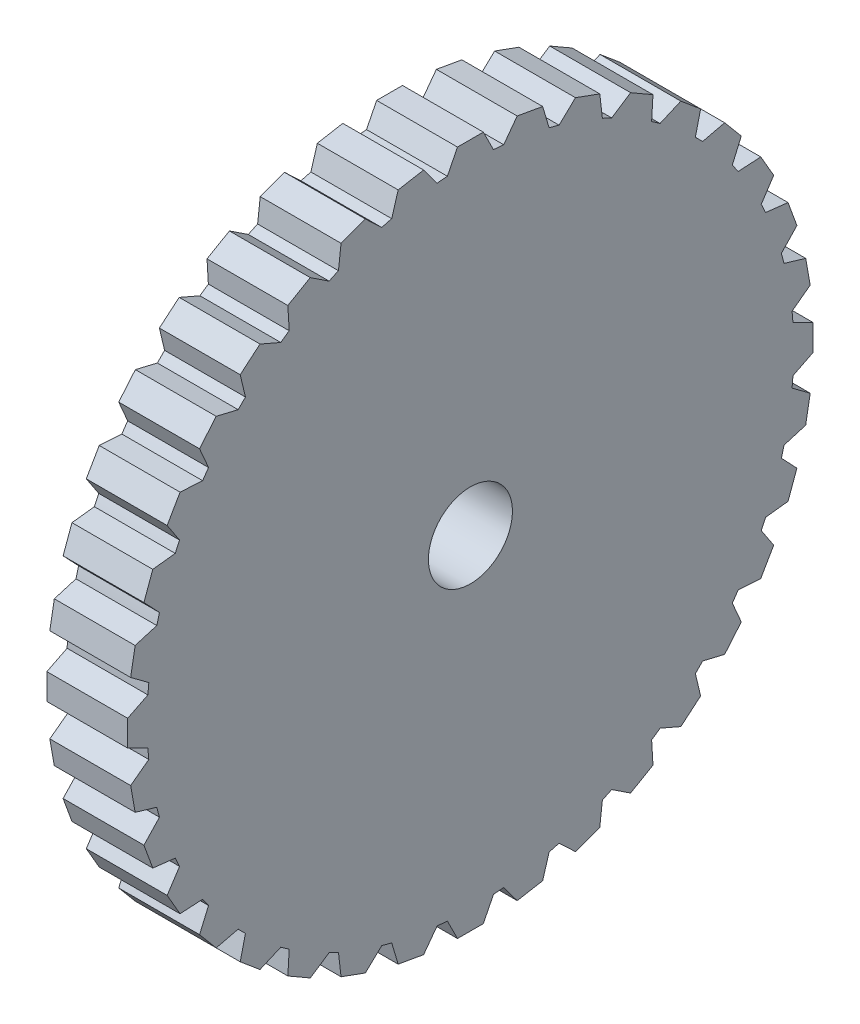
SolidWorks part; units mm, degrees
ref_plane "Front Plane" through (0, 0, 0) normal (0, 0, 1) x (1, 0, 0)
ref_plane "Top Plane" through (0, 0, 0) normal (0, 1, 0) x (1, 0, 0)
ref_plane "Right Plane" through (0, 0, 0) normal (1, 0, 0) x (0, 0, -1)
sketch "Sketch1" plane through (0, 0, 0) normal (1, 0, 0) x (0, 0, -1)
  circle A0 centre (0, 0) radius 12.7
extrude "Boss-Extrude1" add sketch "Sketch1" along normal blind 3.175
sketch "Sketch2" plane through (3.175, 0, 0) normal (1, 0, 0) x (0, 0, -1)
  line L0 (1.8374, 13.3457) -> (2.8379, 13.1693)
  line L1 (2.8379, 13.1693) -> (3.1618, 12.0805)
  line L2 (-0.508, 13.462) -> (0.508, 13.462)
  line L3 (0.508, 13.462) -> (1.016, 12.446)
  line L4 (-1.016, 12.446) -> (1.016, 12.446)
  line L5 (-0.508, 13.462) -> (-1.016, 12.446)
  line L6 (1.1607, 12.4333) -> (3.1618, 12.0805)
  line L7 (1.8374, 13.3457) -> (1.1607, 12.4333)
  line L8 (4.1269, 12.8239) -> (5.0816, 12.4764)
  line L9 (5.0816, 12.4764) -> (5.2115, 11.3479)
  line L10 (3.3021, 12.0429) -> (5.2115, 11.3479)
  line L11 (4.1269, 12.8239) -> (3.3021, 12.0429)
  line L12 (6.2911, 11.9124) -> (7.1709, 11.4044)
  line L13 (7.1709, 11.4044) -> (7.1029, 10.2706)
  line L14 (5.3431, 11.2866) -> (7.1029, 10.2706)
  line L15 (6.2911, 11.9124) -> (5.3431, 11.2866)
  line L16 (8.2641, 10.639) -> (9.0424, 9.986)
  line L17 (9.0424, 9.986) -> (8.7784, 8.8811)
  line L18 (7.2218, 10.1873) -> (8.7784, 8.8811)
  line L19 (8.2641, 10.639) -> (7.2218, 10.1873)
  line L20 (9.986, 9.0424) -> (10.639, 8.2641)
  line L21 (10.639, 8.2641) -> (10.1873, 7.2218)
  line L22 (8.8811, 8.7784) -> (10.1873, 7.2218)
  line L23 (9.986, 9.0424) -> (8.8811, 8.7784)
  line L24 (11.4044, 7.1709) -> (11.9124, 6.2911)
  line L25 (11.9124, 6.2911) -> (11.2866, 5.3431)
  line L26 (10.2706, 7.1029) -> (11.2866, 5.3431)
  line L27 (11.4044, 7.1709) -> (10.2706, 7.1029)
  line L28 (12.4764, 5.0816) -> (12.8239, 4.1269)
  line L29 (12.8239, 4.1269) -> (12.0429, 3.3021)
  line L30 (11.3479, 5.2115) -> (12.0429, 3.3021)
  line L31 (12.4764, 5.0816) -> (11.3479, 5.2115)
  line L32 (13.1693, 2.8379) -> (13.3457, 1.8374)
  line L33 (13.3457, 1.8374) -> (12.4333, 1.1607)
  line L34 (12.0805, 3.1618) -> (12.4333, 1.1607)
  line L35 (13.1693, 2.8379) -> (12.0805, 3.1618)
  line L36 (13.462, 0.508) -> (13.462, -0.508)
  line L37 (13.462, -0.508) -> (12.446, -1.016)
  line L38 (12.446, 1.016) -> (12.446, -1.016)
  line L39 (13.462, 0.508) -> (12.446, 1.016)
  line L40 (13.3457, -1.8374) -> (13.1693, -2.8379)
  line L41 (13.1693, -2.8379) -> (12.0805, -3.1618)
  line L42 (12.4333, -1.1607) -> (12.0805, -3.1618)
  line L43 (13.3457, -1.8374) -> (12.4333, -1.1607)
  line L44 (12.8239, -4.1269) -> (12.4764, -5.0816)
  line L45 (12.4764, -5.0816) -> (11.3479, -5.2115)
  line L46 (12.0429, -3.3021) -> (11.3479, -5.2115)
  line L47 (12.8239, -4.1269) -> (12.0429, -3.3021)
  line L48 (11.9124, -6.2911) -> (11.4044, -7.1709)
  line L49 (11.4044, -7.1709) -> (10.2706, -7.1029)
  line L50 (11.2866, -5.3431) -> (10.2706, -7.1029)
  line L51 (11.9124, -6.2911) -> (11.2866, -5.3431)
  line L52 (10.639, -8.2641) -> (9.986, -9.0424)
  line L53 (9.986, -9.0424) -> (8.8811, -8.7784)
  line L54 (10.1873, -7.2218) -> (8.8811, -8.7784)
  line L55 (10.639, -8.2641) -> (10.1873, -7.2218)
  line L56 (9.0424, -9.986) -> (8.2641, -10.639)
  line L57 (8.2641, -10.639) -> (7.2218, -10.1873)
  line L58 (8.7784, -8.8811) -> (7.2218, -10.1873)
  line L59 (9.0424, -9.986) -> (8.7784, -8.8811)
  line L60 (7.1709, -11.4044) -> (6.2911, -11.9124)
  line L61 (6.2911, -11.9124) -> (5.3431, -11.2866)
  line L62 (7.1029, -10.2706) -> (5.3431, -11.2866)
  line L63 (7.1709, -11.4044) -> (7.1029, -10.2706)
  line L64 (5.0816, -12.4764) -> (4.1269, -12.8239)
  line L65 (4.1269, -12.8239) -> (3.3021, -12.0429)
  line L66 (5.2115, -11.3479) -> (3.3021, -12.0429)
  line L67 (5.0816, -12.4764) -> (5.2115, -11.3479)
  line L68 (2.8379, -13.1693) -> (1.8374, -13.3457)
  line L69 (1.8374, -13.3457) -> (1.1607, -12.4333)
  line L70 (3.1618, -12.0805) -> (1.1607, -12.4333)
  line L71 (2.8379, -13.1693) -> (3.1618, -12.0805)
  line L72 (0.508, -13.462) -> (-0.508, -13.462)
  line L73 (-0.508, -13.462) -> (-1.016, -12.446)
  line L74 (1.016, -12.446) -> (-1.016, -12.446)
  line L75 (0.508, -13.462) -> (1.016, -12.446)
  line L76 (-1.8374, -13.3457) -> (-2.8379, -13.1693)
  line L77 (-2.8379, -13.1693) -> (-3.1618, -12.0805)
  line L78 (-1.1607, -12.4333) -> (-3.1618, -12.0805)
  line L79 (-1.8374, -13.3457) -> (-1.1607, -12.4333)
  line L80 (-4.1269, -12.8239) -> (-5.0816, -12.4764)
  line L81 (-5.0816, -12.4764) -> (-5.2115, -11.3479)
  line L82 (-3.3021, -12.0429) -> (-5.2115, -11.3479)
  line L83 (-4.1269, -12.8239) -> (-3.3021, -12.0429)
  line L84 (-6.2911, -11.9124) -> (-7.1709, -11.4044)
  line L85 (-7.1709, -11.4044) -> (-7.1029, -10.2706)
  line L86 (-5.3431, -11.2866) -> (-7.1029, -10.2706)
  line L87 (-6.2911, -11.9124) -> (-5.3431, -11.2866)
  line L88 (-8.2641, -10.639) -> (-9.0424, -9.986)
  line L89 (-9.0424, -9.986) -> (-8.7784, -8.8811)
  line L90 (-7.2218, -10.1873) -> (-8.7784, -8.8811)
  line L91 (-8.2641, -10.639) -> (-7.2218, -10.1873)
  line L92 (-9.986, -9.0424) -> (-10.639, -8.2641)
  line L93 (-10.639, -8.2641) -> (-10.1873, -7.2218)
  line L94 (-8.8811, -8.7784) -> (-10.1873, -7.2218)
  line L95 (-9.986, -9.0424) -> (-8.8811, -8.7784)
  line L96 (-11.4044, -7.1709) -> (-11.9124, -6.2911)
  line L97 (-11.9124, -6.2911) -> (-11.2866, -5.3431)
  line L98 (-10.2706, -7.1029) -> (-11.2866, -5.3431)
  line L99 (-11.4044, -7.1709) -> (-10.2706, -7.1029)
  line L100 (-12.4764, -5.0816) -> (-12.8239, -4.1269)
  line L101 (-12.8239, -4.1269) -> (-12.0429, -3.3021)
  line L102 (-11.3479, -5.2115) -> (-12.0429, -3.3021)
  line L103 (-12.4764, -5.0816) -> (-11.3479, -5.2115)
  line L104 (-13.1693, -2.8379) -> (-13.3457, -1.8374)
  line L105 (-13.3457, -1.8374) -> (-12.4333, -1.1607)
  line L106 (-12.0805, -3.1618) -> (-12.4333, -1.1607)
  line L107 (-13.1693, -2.8379) -> (-12.0805, -3.1618)
  line L108 (-13.462, -0.508) -> (-13.462, 0.508)
  line L109 (-13.462, 0.508) -> (-12.446, 1.016)
  line L110 (-12.446, -1.016) -> (-12.446, 1.016)
  line L111 (-13.462, -0.508) -> (-12.446, -1.016)
  line L112 (-13.3457, 1.8374) -> (-13.1693, 2.8379)
  line L113 (-13.1693, 2.8379) -> (-12.0805, 3.1618)
  line L114 (-12.4333, 1.1607) -> (-12.0805, 3.1618)
  line L115 (-13.3457, 1.8374) -> (-12.4333, 1.1607)
  line L116 (-12.8239, 4.1269) -> (-12.4764, 5.0816)
  line L117 (-12.4764, 5.0816) -> (-11.3479, 5.2115)
  line L118 (-12.0429, 3.3021) -> (-11.3479, 5.2115)
  line L119 (-12.8239, 4.1269) -> (-12.0429, 3.3021)
  line L120 (-11.9124, 6.2911) -> (-11.4044, 7.1709)
  line L121 (-11.4044, 7.1709) -> (-10.2706, 7.1029)
  line L122 (-11.2866, 5.3431) -> (-10.2706, 7.1029)
  line L123 (-11.9124, 6.2911) -> (-11.2866, 5.3431)
  line L124 (-10.639, 8.2641) -> (-9.986, 9.0424)
  line L125 (-9.986, 9.0424) -> (-8.8811, 8.7784)
  line L126 (-10.1873, 7.2218) -> (-8.8811, 8.7784)
  line L127 (-10.639, 8.2641) -> (-10.1873, 7.2218)
  line L128 (-9.0424, 9.986) -> (-8.2641, 10.639)
  line L129 (-8.2641, 10.639) -> (-7.2218, 10.1873)
  line L130 (-8.7784, 8.8811) -> (-7.2218, 10.1873)
  line L131 (-9.0424, 9.986) -> (-8.7784, 8.8811)
  line L132 (-7.1709, 11.4044) -> (-6.2911, 11.9124)
  line L133 (-6.2911, 11.9124) -> (-5.3431, 11.2866)
  line L134 (-7.1029, 10.2706) -> (-5.3431, 11.2866)
  line L135 (-7.1709, 11.4044) -> (-7.1029, 10.2706)
  line L136 (-5.0816, 12.4764) -> (-4.1269, 12.8239)
  line L137 (-4.1269, 12.8239) -> (-3.3021, 12.0429)
  line L138 (-5.2115, 11.3479) -> (-3.3021, 12.0429)
  line L139 (-5.0816, 12.4764) -> (-5.2115, 11.3479)
  line L140 (-2.8379, 13.1693) -> (-1.8374, 13.3457)
  line L141 (-1.8374, 13.3457) -> (-1.1607, 12.4333)
  line L142 (-3.1618, 12.0805) -> (-1.1607, 12.4333)
  line L143 (-2.8379, 13.1693) -> (-3.1618, 12.0805)
  point P10 (0, 12.446)
  dimension "D1" = 36
extrude "Boss-Extrude2" add sketch "Sketch2" against normal blind 3.175
sketch "Sketch3" plane through (3.175, 0, 0) normal (1, 0, 0) x (0, 0, -1)
  circle A0 centre (0, 0) radius 1.651
extrude "Cut-Extrude1" cut sketch "Sketch3" against normal blind 3.175
